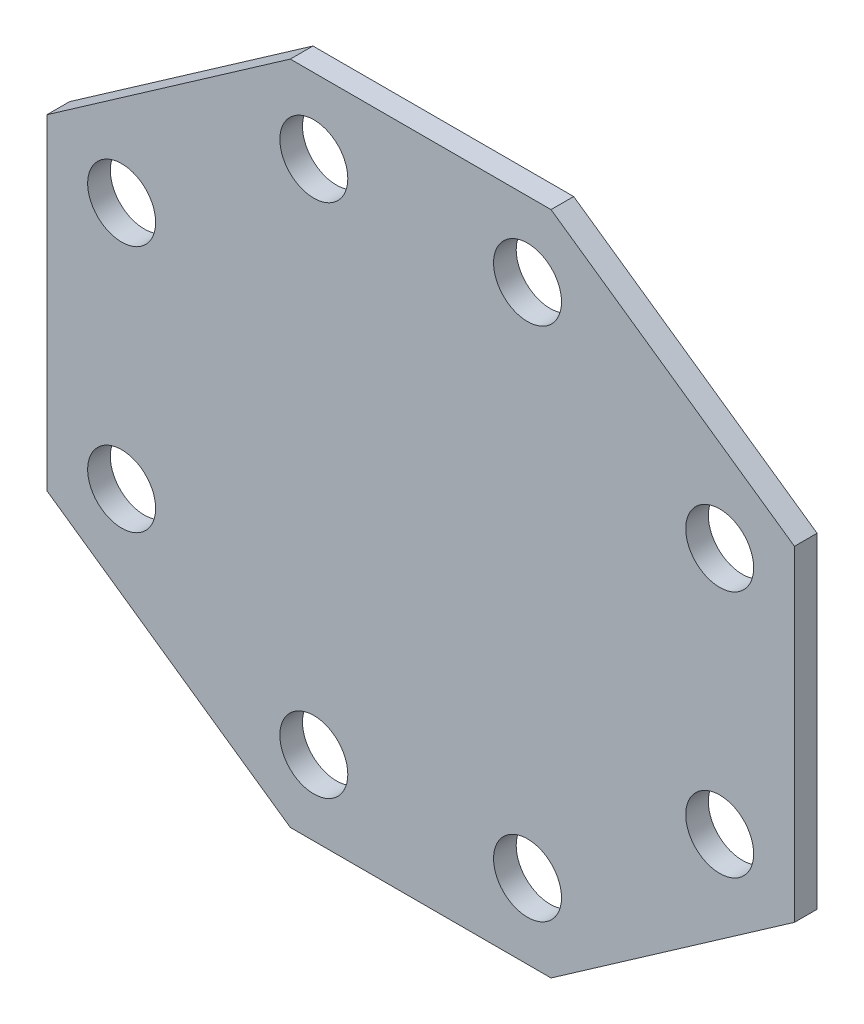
SolidWorks part; units mm, degrees
ref_plane "Front Plane" through (0, 0, 0) normal (1, 0, 0) x (0, 1, 0)
ref_plane "Top Plane" through (0, 0, 0) normal (0, 0, 1) x (0, 1, 0)
ref_plane "Right Plane" through (0, 0, 0) normal (0, 1, 0) x (-1, 0, 0)
sketch "sk W14x730" plane through (0, 0, 0) normal (0, 0, 1) x (0, 1, 0)
  point P0 (0, -284.734)
  point P1 (-38.989, 0)
  line B0 (-227.203, -284.734) -> (-227.203, -160.02)
  line B1 (-227.203, -160.02) -> (-54.229, -160.02)
  line B2 (-38.989, -144.78) -> (-38.989, 144.78)
  line B3 (-54.229, 160.02) -> (-227.203, 160.02)
  line B4 (-227.203, 160.02) -> (-227.203, 284.734)
  line B5 (-227.203, 284.734) -> (227.203, 284.734)
  line B6 (227.203, 284.734) -> (227.203, 160.02)
  line B7 (227.203, 160.02) -> (54.229, 160.02)
  line B8 (38.989, 144.78) -> (38.989, -144.78)
  line B9 (54.229, -160.02) -> (227.203, -160.02)
  line B10 (227.203, -160.02) -> (227.203, -284.734)
  line B11 (227.203, -284.734) -> (-227.203, -284.734)
  arc B12 (-54.229, -160.02) -> (-38.989, -144.78) centre (-54.229, -144.78) ccw
  arc B13 (-38.989, 144.78) -> (-54.229, 160.02) centre (-54.229, 144.78) ccw
  arc B14 (54.229, 160.02) -> (38.989, 144.78) centre (54.229, 144.78) ccw
  arc B15 (38.989, -144.78) -> (54.229, -160.02) centre (54.229, -144.78) ccw
sketch_block_instance "W14x730-113"
sketch_block "W14x730" parameters "D4"=15.24, "D1"=454.406, "D2"=569.468, "D3"=77.978, "D5"=124.714
sketch_block_instance "W14x730-232"
sketch_block_instance "W14x730-233"
sketch_block_instance "W14x730-234"
sketch_block_instance "W14x730-276"
sketch_block_instance "W14x730-277"
sketch_block_instance "W14x730-278"
sketch_block_instance "W14x730-279"
sketch_block_instance "W14x730-280"
sketch_block_instance "W14x730-281"
sketch_block_instance "W14x730-282"
sketch_block_instance "W14x730-283"
sketch_block_instance "W14x730-284"
sketch_block_instance "W14x730-285"
sketch_block_instance "W14x730-286"
sketch_block_instance "W14x730-287"
sketch_block_instance "W14x730-288"
sketch_block_instance "W14x730-289"
sketch_block_instance "W14x730-321"
sketch_block_instance "W14x730-322"
sketch_block_instance "W14x730-323"
sketch_block_instance "W14x730-324"
sketch_block_instance "W14x730-325"
sketch_block_instance "W14x730-326"
sketch_block_instance "W14x730-327"
sketch_block_instance "W14x730-328"
sketch_block_instance "W14x730-329"
sketch_block_instance "W14x730-330"
sketch_block_instance "W14x730-331"
sketch_block_instance "W14x730-332"
sketch_block_instance "W14x730-333"
sketch_block_instance "W14x730-334"
sketch_block_instance "W14x730-335"
sketch_block_instance "W14x730-336"
sketch_block_instance "W14x730-337"
sketch_block_instance "W14x730-338"
sketch_block_instance "W14x730-339"
sketch_block_instance "W14x730-340"
sketch_block_instance "W14x730-341"
sketch_block_instance "W14x730-365"
sketch_block_instance "W14x730-366"
sketch_block_instance "W14x730-367"
sketch_block_instance "W14x730-368"
sketch_block_instance "W14x730-369"
sketch_block_instance "W14x730-370"
sketch_block_instance "W14x730-371"
sketch_block_instance "W14x730-372"
sketch_block_instance "W14x730-373"
sketch_block_instance "W14x730-374"
sketch_block_instance "W14x730-375"
sketch_block_instance "W14x730-376"
sketch_block_instance "W14x730-377"
sketch_block_instance "W14x730-378"
sketch_block_instance "W14x730-379"
sketch_block_instance "W14x730-380"
sketch_block_instance "W14x730-381"
sketch_block_instance "W14x730-382"
sketch_block_instance "W14x730-383"
sketch_block_instance "W14x730-384"
sketch_block_instance "W14x730-385"
sketch_block_instance "W14x730-386"
sketch_block_instance "W14x730-387"
sketch_block_instance "W14x730-388"
sketch_block_instance "W14x730-389"
sketch_block_instance "W14x730-390"
sketch_block_instance "W14x730-391"
sketch_block_instance "W14x730-410"
sketch_block_instance "W14x730-411"
sketch_block_instance "W14x730-412"
sketch_block_instance "W14x730-413"
sketch_block_instance "W14x730-414"
sketch_block_instance "W14x730-415"
sketch_block_instance "W14x730-416"
sketch_block_instance "W14x730-417"
sketch_block_instance "W14x730-418"
sketch_block_instance "W14x730-419"
sketch_block_instance "W14x730-420"
sketch_block_instance "W14x730-421"
sketch_block_instance "W14x730-422"
sketch_block_instance "W14x730-423"
sketch_block_instance "W14x730-424"
sketch_block_instance "W14x730-425"
sketch_block_instance "W14x730-426"
sketch_block_instance "W14x730-427"
sketch_block_instance "W14x730-428"
sketch_block_instance "W14x730-429"
sketch_block_instance "W14x730-430"
sketch_block_instance "W14x730-431"
sketch_block_instance "W14x730-432"
sketch_block_instance "W14x730-433"
sketch_block_instance "W14x730-434"
sketch_block_instance "W14x730-435"
sketch_block_instance "W14x730-436"
sketch_block_instance "W14x730-437"
sketch_block_instance "W14x730-438"
sketch_block_instance "W14x730-439"
sketch_block_instance "W14x730-440"
sketch_block_instance "W14x730-443"
sketch_block_instance "W14x730-454"
sketch_block_instance "W14x730-455"
sketch_block_instance "W14x730-456"
sketch_block_instance "W14x730-457"
sketch_block_instance "W14x730-458"
sketch_block_instance "W14x730-459"
sketch_block_instance "W14x730-460"
sketch_block_instance "W14x730-461"
sketch_block_instance "W14x730-462"
sketch_block_instance "W14x730-463"
sketch_block_instance "W14x730-464"
sketch_block_instance "W14x730-465"
sketch_block_instance "W14x730-466"
sketch_block_instance "W14x730-467"
sketch_block_instance "W14x730-468"
sketch_block_instance "W14x730-469"
sketch_block_instance "W14x730-470"
sketch_block_instance "W14x730-471"
sketch_block_instance "W14x730-472"
sketch_block_instance "W14x730-473"
sketch_block_instance "W14x730-474"
sketch_block_instance "W14x730-475"
sketch_block_instance "W14x730-476"
sketch_block_instance "W14x730-477"
sketch_block_instance "W14x730-478"
sketch_block_instance "W14x730-479"
sketch_block_instance "W14x730-480"
sketch_block_instance "W14x730-481"
sketch_block_instance "W14x730-482"
sketch_block_instance "W14x730-483"
sketch_block_instance "W14x730-484"
sketch_block_instance "W14x730-485"
sketch_block_instance "W14x730-486"
sketch_block_instance "W14x730-487"
sketch_block_instance "W14x730-488"
sketch_block_instance "W14x730-489"
sketch_block_instance "W14x730-490" parameters "D1"=817.9177, "D2"=1027.7361, "D3"=0.4058, "D4"=24.0009, "D5"=0.4058, "D6"=533.4, "D7"=27.3509, "D8"=8374.3758, "D9"=3499.6788, "D10"=18059.4
sketch "sk 4\" hex nut Pattern" plane through (0, 0, 0) normal (0, 0, 1) x (0, 1, 0)
  line L7 (419.0803, -173.5887) -> (419.0803, 173.5887)
  line L8 (419.0803, 173.5887) -> (173.5887, 419.0803)
  line L9 (173.5887, 419.0803) -> (-173.5887, 419.0803)
  line L10 (-173.5887, 419.0803) -> (-419.0803, 173.5887)
  line L11 (-419.0803, 173.5887) -> (-419.0803, -173.5887)
  line L12 (-419.0803, -173.5887) -> (-173.5887, -419.0803)
  line L13 (-173.5887, -419.0803) -> (173.5887, -419.0803)
  line L14 (173.5887, -419.0803) -> (419.0803, -173.5887)
  line L29 (54.229, -125.02) -> (262.203, -125.02)
  line L30 (262.203, -125.02) -> (262.203, -319.734)
  line L31 (-262.203, -125.02) -> (-54.229, -125.02)
  line L32 (-262.203, -319.734) -> (-262.203, -125.02)
  line L33 (262.203, -319.734) -> (-262.203, -319.734)
  line L34 (54.229, -125.02) -> (262.203, -125.02)
  line L35 (262.203, -125.02) -> (262.203, -319.734)
  line L36 (-262.203, -125.02) -> (-54.229, -125.02)
  line L37 (-262.203, -319.734) -> (-262.203, -125.02)
  line L38 (262.203, -319.734) -> (-262.203, -319.734)
  line L39 (-419.0803, 173.5887) -> (419.0803, -173.5887)
  line L40 (419.0803, 173.5887) -> (-419.0803, -173.5887)
  line L42 (-466.3243, 523.8553) -> (466.3243, 523.8553)
  line L43 (-466.3243, 523.8553) -> (-466.3243, -523.8553)
  line L44 (262.203, 125.02) -> (54.229, 125.02)
  line L45 (262.203, 319.734) -> (262.203, 125.02)
  line L46 (-262.203, 319.734) -> (262.203, 319.734)
  line L47 (-262.203, 125.02) -> (-262.203, 319.734)
  line L48 (-54.229, 125.02) -> (-262.203, 125.02)
  line L49 (262.203, 125.02) -> (54.229, 125.02)
  line L50 (262.203, 319.734) -> (262.203, 125.02)
  line L51 (-262.203, 319.734) -> (262.203, 319.734)
  line L52 (-262.203, 125.02) -> (-262.203, 319.734)
  line L53 (-54.229, 125.02) -> (-262.203, 125.02)
  line L54 (-466.3243, -523.8553) -> (466.3243, -523.8553)
  line L55 (466.3243, 523.8553) -> (466.3243, -523.8553)
  circle A0 centre (0, 0) radius 419.0803 construction
  line B0 (-128.6781, -496.8678) -> (-83.7675, -419.0803)
  circle B1 centre (-173.5887, -419.0803) radius 77.7875 construction
  circle B2 centre (-173.5887, -419.0803) radius 50.8
  circle B3 centre (-173.5887, -419.0803) radius 89.8213
  circle B4 centre (-173.5887, -419.0803) radius 99.3463
  line B5 (-83.7675, 419.0803) -> (-128.6781, 496.8678)
  line B6 (-128.6781, 496.8678) -> (-218.4994, 496.8678)
  line B7 (-218.4994, 496.8678) -> (-263.41, 419.0803)
  line B8 (-263.41, 419.0803) -> (-218.4994, 341.2928)
  line B9 (-218.4994, 341.2928) -> (-128.6781, 341.2928)
  circle B10 centre (-173.5887, 419.0803) radius 77.7875 construction
  circle B11 centre (-173.5887, 419.0803) radius 50.8
  circle B12 centre (-173.5887, 419.0803) radius 89.8213
  circle B13 centre (-173.5887, 419.0803) radius 99.3463
  line B14 (263.41, 419.0803) -> (218.4994, 496.8678)
  line B15 (218.4994, 496.8678) -> (128.6781, 496.8678)
  line B16 (128.6781, 496.8678) -> (83.7675, 419.0803)
  line B17 (128.6781, 341.2928) -> (218.4994, 341.2928)
  line B18 (218.4994, 341.2928) -> (263.41, 419.0803)
  circle B19 centre (173.5887, 419.0803) radius 50.8
  circle B20 centre (173.5887, 419.0803) radius 89.8213
  circle B21 centre (173.5887, 419.0803) radius 99.3463
  line B22 (263.41, -419.0803) -> (218.4994, -341.2928)
  line B23 (218.4994, -341.2928) -> (128.6781, -341.2928)
  line B24 (83.7675, -419.0803) -> (128.6781, -496.8678)
  line B25 (128.6781, -496.8678) -> (218.4994, -496.8678)
  line B26 (218.4994, -496.8678) -> (263.41, -419.0803)
  circle B27 centre (173.5887, -419.0803) radius 77.7875 construction
  circle B28 centre (173.5887, -419.0803) radius 50.8
  circle B29 centre (173.5887, -419.0803) radius 89.8213
  circle B30 centre (173.5887, -419.0803) radius 99.3463
  line B31 (-271.728, 149.7586) -> (-316.6386, 227.5461)
  line B32 (-316.6386, 227.5461) -> (-406.4599, 227.5461)
  line B33 (-406.4599, 227.5461) -> (-451.3705, 149.7586)
  line B34 (-451.3705, 149.7586) -> (-406.4599, 71.9711)
  line B35 (-406.4599, 71.9711) -> (-316.6386, 71.9711)
  circle B36 centre (-361.5493, 149.7586) radius 77.7875 construction
  circle B37 centre (-361.5493, 149.7586) radius 50.8
  circle B38 centre (-361.5493, 149.7586) radius 89.8213
  circle B39 centre (-361.5493, 149.7586) radius 99.3463
  line B40 (-271.728, -149.7586) -> (-316.6386, -71.9711)
  line B41 (-316.6386, -71.9711) -> (-406.4599, -71.9711)
  line B42 (-406.4599, -71.9711) -> (-451.3705, -149.7586)
  line B43 (-451.3705, -149.7586) -> (-406.4599, -227.5461)
  line B44 (-406.4599, -227.5461) -> (-316.6386, -227.5461)
  line B45 (-316.6386, -227.5461) -> (-271.728, -149.7586)
  circle B46 centre (-361.5493, -149.7586) radius 77.7875 construction
  circle B47 centre (-361.5493, -149.7586) radius 50.8
  circle B48 centre (-361.5493, -149.7586) radius 89.8213
  circle B49 centre (-361.5493, -149.7586) radius 99.3463
  line B50 (451.3705, 149.7586) -> (406.4599, 227.5461)
  line B51 (406.4599, 227.5461) -> (316.6386, 227.5461)
  line B52 (316.6386, 227.5461) -> (271.728, 149.7586)
  line B53 (316.6386, 71.9711) -> (406.4599, 71.9711)
  circle B54 centre (361.5493, 149.7586) radius 77.7875 construction
  circle B55 centre (361.5493, 149.7586) radius 50.8
  circle B56 centre (361.5493, 149.7586) radius 89.8213
  circle B57 centre (361.5493, 149.7586) radius 99.3463
  line B58 (316.6386, -71.9711) -> (271.728, -149.7586)
  line B59 (406.4599, -227.5461) -> (451.3705, -149.7586)
  circle B60 centre (361.5493, -149.7586) radius 77.7875 construction
  circle B61 centre (361.5493, -149.7586) radius 50.8
  circle B62 centre (361.5493, -149.7586) radius 89.8213
  circle B63 centre (361.5493, -149.7586) radius 99.3463
sketch_block_instance "4\" hex nut-1"
sketch_block "4\" hex nut" parameters "D1"=155.575, "D2"=101.6, "D3"=9.525
sketch_block_instance "4\" hex nut-2"
sketch_block_instance "4\" hex nut-3"
sketch_block_instance "4\" hex nut-4"
sketch_block_instance "4\" hex nut-5"
sketch_block_instance "4\" hex nut-6"
sketch_block_instance "4\" hex nut-7"
sketch_block_instance "4\" hex nut-8" parameters "D1"=129.9071, "D2"=77.383, "D3"=138.8929, "D4"=187.7059, "D5"=195.0068, "D6"=231.3326
sketch "Sketch3" plane through (0, 0, 0) normal (0, 0, 1) x (0, 1, 0)
  line L0 (-466.3243, 523.8553) -> (466.3243, 523.8553) construction
  line L1 (466.3243, 523.8553) -> (466.3243, -523.8553) construction
  line L2 (-466.3243, -523.8553) -> (466.3243, -523.8553) construction
  line L3 (-466.3243, 523.8553) -> (-466.3243, -523.8553) construction
  line L4 (228.2342, 523.8553) -> (466.3243, 182.7049)
  line L5 (466.3243, 182.7049) -> (466.3243, -182.7049)
  line L6 (466.3243, -182.7049) -> (228.2342, -523.8553)
  line L7 (228.2342, -523.8553) -> (-228.2342, -523.8553)
  line L8 (-228.2342, -523.8553) -> (-466.3243, -182.7049)
  line L9 (-466.3243, -182.7049) -> (-466.3243, 182.7049)
  line L10 (-466.3243, 182.7049) -> (-228.2342, 523.8553)
  line L11 (-228.2342, 523.8553) -> (228.2342, 523.8553)
  line L93 (-54.229, 156.845) -> (-230.378, 156.845)
  line L94 (-230.378, 156.845) -> (-230.378, 287.909)
  line L95 (230.378, 156.845) -> (54.229, 156.845)
  line L96 (230.378, 287.909) -> (230.378, 156.845)
  line L97 (-230.378, 287.909) -> (230.378, 287.909)
  line L98 (-54.229, 156.845) -> (-230.378, 156.845) construction
  line L99 (-230.378, 156.845) -> (-230.378, 287.909) construction
  line L100 (230.378, 156.845) -> (54.229, 156.845) construction
  line L101 (230.378, 287.909) -> (230.378, 156.845) construction
  line L102 (-230.378, 287.909) -> (230.378, 287.909) construction
  line L118 (54.229, -156.845) -> (230.378, -156.845)
  line L119 (230.378, -156.845) -> (230.378, -287.909)
  line L120 (230.378, -287.909) -> (-230.378, -287.909)
  line L121 (-230.378, -287.909) -> (-230.378, -156.845)
  line L122 (-230.378, -156.845) -> (-54.229, -156.845)
  line L123 (54.229, -156.845) -> (230.378, -156.845) construction
  line L124 (230.378, -156.845) -> (230.378, -287.909) construction
  line L125 (230.378, -287.909) -> (-230.378, -287.909) construction
  line L126 (-230.378, -287.909) -> (-230.378, -156.845) construction
  line L127 (-230.378, -156.845) -> (-54.229, -156.845) construction
  line L130 (42.164, 144.78) -> (42.164, -144.78)
  line L131 (42.164, 144.78) -> (42.164, -144.78) construction
  line L132 (-54.229, 156.845) -> (-42.164, 144.78) construction
  line L133 (-42.164, -144.78) -> (-42.164, 144.78)
  line L134 (-42.164, -144.78) -> (-42.164, 144.78) construction
  line L135 (42.164, 144.78) -> (54.229, 156.845) construction
  line L136 (42.164, -144.78) -> (54.229, -156.845) construction
  line L137 (-54.229, -156.845) -> (-42.164, -144.78) construction
  circle A0 centre (173.5887, 419.0803) radius 104.775 construction
  circle A1 centre (-173.5887, 419.0803) radius 104.775 construction
  circle A2 centre (-361.5493, 149.7586) radius 104.775 construction
  circle A3 centre (-361.5493, -149.7586) radius 104.775 construction
  circle A4 centre (-173.5887, -419.0803) radius 104.775 construction
  circle A5 centre (173.5887, -419.0803) radius 104.775 construction
  circle A6 centre (361.5493, -149.7586) radius 104.775 construction
  circle A7 centre (361.5493, 149.7586) radius 104.775 construction
  dimension "D1" = 3.175
  dimension "D2" = 3.175
  dimension "D3" = 3.175
  dimension "D4" = 3.175
extrude "Main Plate" add sketch "Sketch3" along normal blind 31.75
sketch "Sketch5" plane through (0, 0, 0) normal (0, 0, 1) x (0, 1, 0)
  circle A0 centre (-173.5887, 419.0803) radius 47.625
  circle A1 centre (173.5887, 419.0803) radius 47.625
  circle A2 centre (361.5493, 149.7586) radius 47.625
  circle A3 centre (361.5493, -149.7586) radius 47.625
  circle A4 centre (173.5887, -419.0803) radius 47.625
  circle A5 centre (-173.5887, -419.0803) radius 47.625
  circle A6 centre (-361.5493, -149.7586) radius 47.625
  circle A7 centre (-361.5493, 149.7586) radius 47.625
  dimension "D1" = 95.25
  dimension "D2" = 95.25
  dimension "D3" = 95.25
  dimension "D4" = 95.25
  dimension "D5" = 95.25
  dimension "D6" = 95.25
  dimension "D7" = 95.25
  dimension "D8" = 95.25
extrude "Cut-Extrude1" cut sketch "Sketch5" against normal through all both and the other way through all
